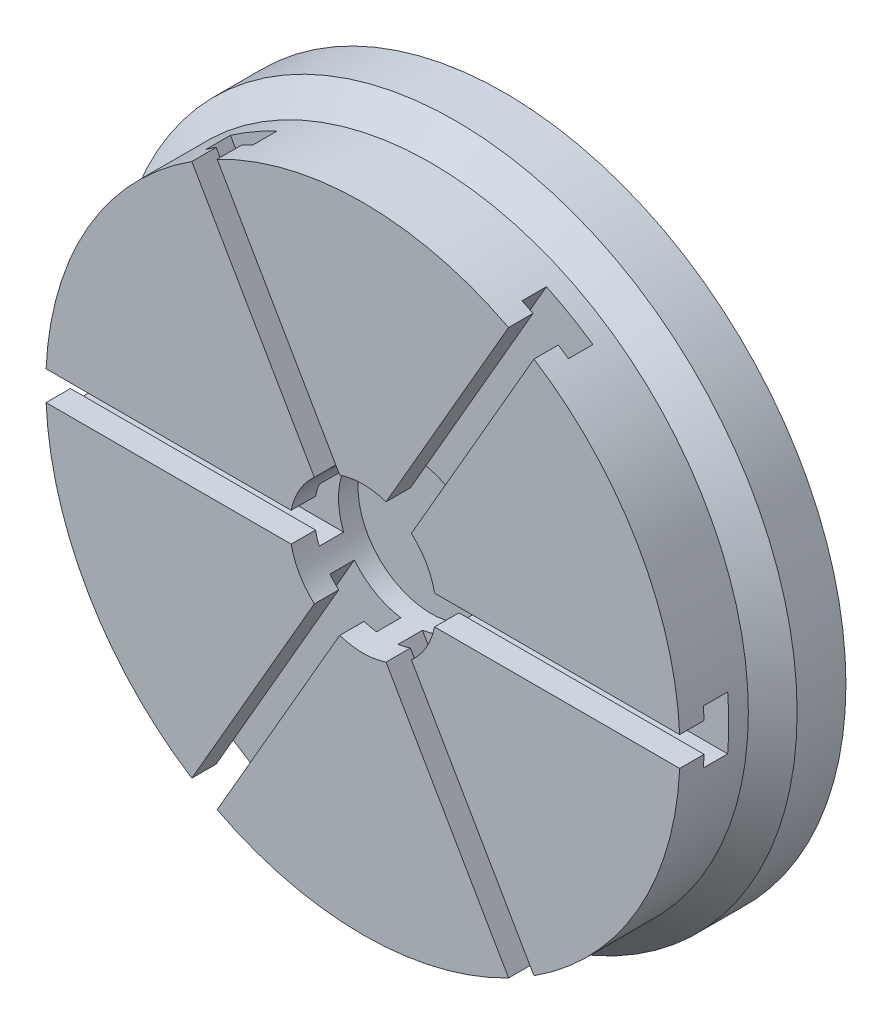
SolidWorks part; units mm, degrees
ref_plane "Face" through (0, 0, 0) normal (0, 0, 1) x (1, 0, 0)
ref_plane "Dessus" through (0, 0, 0) normal (0, 1, 0) x (1, 0, 0)
ref_plane "Droite" through (0, 0, 0) normal (1, 0, 0) x (0, 0, -1)
sketch "Esquisse1" plane through (0, 0, 0) normal (0, 0, 1) x (1, 0, 0)
  circle A0 centre (0, 0) radius 140
  dimension "D1" = 280
extrude "Extrusion1" add sketch "Esquisse1" along normal blind 30
sketch "Esquisse2" plane through (0, 0, 30) normal (0, 0, 1) x (1, 0, 0)
  circle A0 centre (0, 0) radius 130
  dimension "D1" = 260
extrude "Extrusion2" add sketch "Esquisse2" along normal blind 28
chamfer "Chanfrein1" distance 10 angle 45 1 edges at (140, 0, 30)
sketch "Esquisse3" plane through (0, 0, 58) normal (0, 0, 1) x (1, 0, 0)
  circle A0 centre (0, 0) radius 30
  dimension "D1" = 60
extrude "Enlèv. mat.-Extru.1" cut sketch "Esquisse3" against normal blind 28
sketch "Esquisse4" plane through (0, 0, 0) normal (1, 0, 0) x (0, 0, -1)
  line L0 (-58, -6) -> (-48, -6)
  line L1 (-48, -6) -> (-48, -11)
  line L2 (-48, -11) -> (-38, -11)
  line L3 (-38, -11) -> (-38, 11)
  line L4 (-38, 11) -> (-48, 11)
  line L5 (-48, 11) -> (-48, 6)
  line L6 (-48, 6) -> (-58, 6)
  line L7 (-58, 6) -> (-58, -6)
  line L8 (-58, 130) -> (-58, -130) construction
  dimension "D1" = 10
  dimension "D2" = 10
  dimension "D3" = 12
  dimension "D4" = 6
  dimension "D5" = 5
extrude "Enlèv. mat.-Extru.2" cut sketch "Esquisse4" against normal through all and the other way through all
pattern_circular "Répétition circulaire1" count 3 over 360 about axis through (0, 0, 0) along (0, 0, 1) of "Enlèv. mat.-Extru.2"
